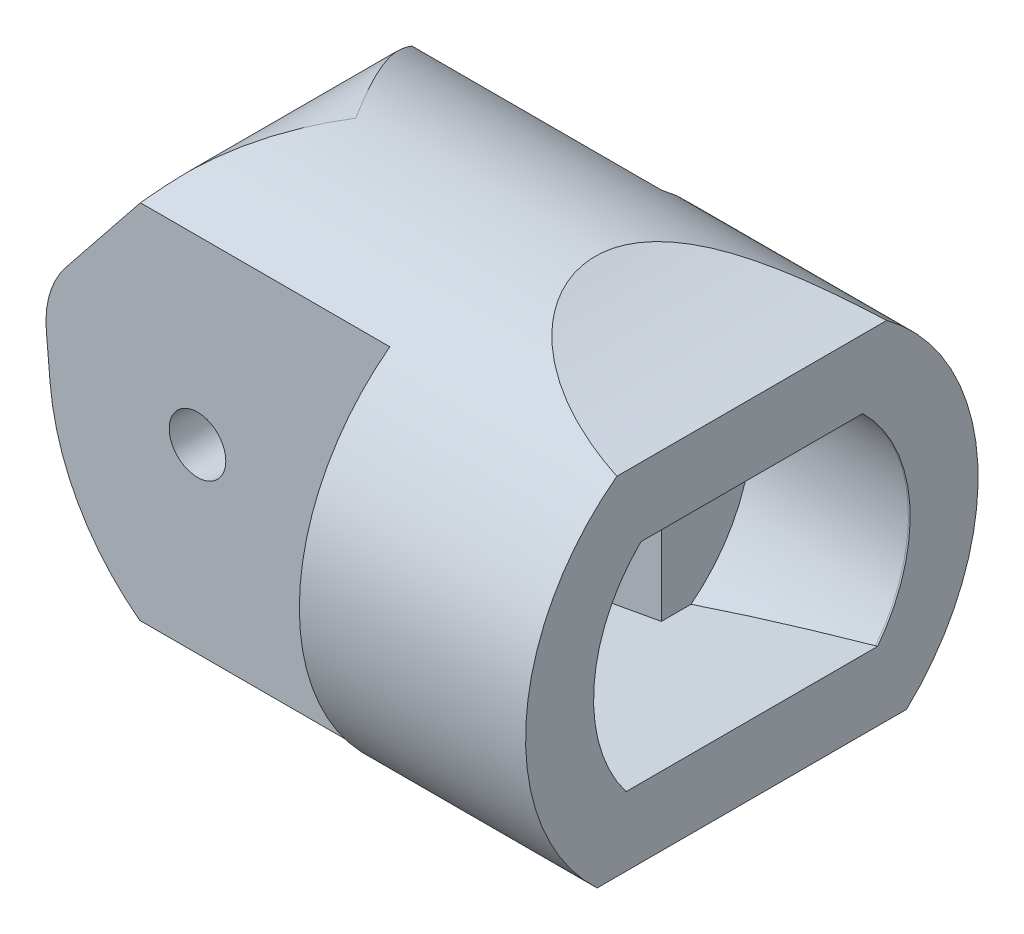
SolidWorks part; units mm, degrees
ref_plane "Plan de face" through (0, 0, 0) normal (0, 0, 1) x (1, 0, 0)
ref_plane "Plan de dessus" through (0, 0, 0) normal (0, 1, 0) x (1, 0, 0)
ref_plane "Plan de droite" through (0, 0, 0) normal (1, 0, 0) x (0, 0, -1)
sketch "Esquisse1" plane through (0, 0, 0) normal (1, 0, 0) x (0, 0, -1)
  circle A0 centre (0, 0) radius 10
  dimension "D1" = 20
extrude "Boss.-Extru.1" add sketch "Esquisse1" against normal blind 26
sketch "Esquisse3" plane through (0, 0, 0) normal (0, 1, 0) x (1, 0, 0)
  line L0 (-26, 0) -> (-26, -6)
  line L2 (0, 0) -> (-26, 0) construction
  line L7 (-26, 10) -> (-26, -10) construction
  line L8 (-26, -10) -> (0, -10) construction
  line L9 (-26, -10) -> (-10, -10)
  line L10 (-26, -10) -> (-26, -6)
  line L11 (-26, 6) -> (-10, 6)
  line L12 (-10, -10) -> (-10, -6)
  line L13 (-10, 10) -> (-10, 6)
  line L14 (-26, -6) -> (-10, -6)
  line L15 (-26, 10) -> (-26, 6)
  line L16 (-26, 10) -> (-10, 10)
  dimension "D4" = 16
  dimension "D5" = 12
extrude "Enlèv. mat.-Extru.1" cut sketch "Esquisse3" against normal through all and the other way through all contours L10 L9 L12 L14 | L15 L11 L13 L16
sketch "Esquisse4" plane through (0, 0, 0) normal (0, 0, 1) x (1, 0, 0)
  line L0 (0, 0) -> (-26, 0) construction
  line L1 (-26, 8) -> (-26, -8) construction
  circle A0 centre (-18.5, 0) radius 1.25
  dimension "D1" = 2.5
  dimension "D2" = 7.5
extrude "Enlèv. mat.-Extru.2" cut sketch "Esquisse4" against normal through all and the other way through all
sketch "Esquisse5" plane through (0, 0, 0) normal (0, 0, 1) x (1, 0, 0)
  line L0 (-25.7147, 6.7385) -> (-25.0489, -0.8716)
  line L1 (-26, -10) -> (0, -10) construction
  line L2 (-15.0869, -10) -> (0, -10)
  line L3 (0, -10) -> (0, 10)
  line L4 (0, 10) -> (-22.7261, 10)
  line L5 (-26, 8) -> (-26, -8) construction
  arc A0 (-15.0869, -10) -> (-25.0489, -0.8716) centre (-15.0869, 0) cw
  arc A1 (-22.7261, 10) -> (-25.7147, 6.7385) centre (-22.7261, 7) ccw
  point P13 (-24.2502, -10)
  point P16 (-26, 10)
  dimension "D2" = 10
  dimension "D3" = 3
  dimension "D1" = 5
extrude "Enlèv. mat.-Extru.3" cut sketch "Esquisse5" against normal through all and the other way through all flip side to cut
sketch "Esquisse6" plane through (0, 0, 0) normal (1, 0, 0) x (0, 0, -1)
  circle A0 centre (0, 0) radius 10
  circle A1 centre (0, 0) radius 10 construction
extrude "Boss.-Extru.2" add sketch "Esquisse6" along normal blind 15 draft 3
sketch "Esquisse7" plane through (0, 0, 0) normal (0, 0, 1) x (1, 0, 0)
  line L0 (0, 10) -> (-17.5013, 10) construction
  line L1 (15, -9.2139) -> (15, 9.2139) construction
  line L2 (15, -4.5865) -> (-14.9606, -10)
  line L3 (-15.0535, -10) -> (0, -10) construction
  line L4 (-14.9606, -10) -> (-14.9606, -14.4411)
  line L5 (-14.9606, -14.4411) -> (23.4972, -14.4411)
  line L6 (23.4972, -14.4411) -> (23.4972, 12.5649)
  line L7 (23.4972, 12.5649) -> (-6.9249, 12.5649)
  line L8 (-6.9249, 12.5649) -> (-6.9249, 10)
  spline S0 degree 3 poles (-6.9249, 10) (-1.613, 7.673) (8.9211, 7.4186) (21.794, 6.6986) (15, -4.5865) knots 0 0 0 0 0.499244 1 1 1 1
extrude "Enlèv. mat.-Extru.4" cut sketch "Esquisse7" against normal through all both and the other way through all
fillet "Congé1" radius 4 2 edges at (15, 1.2954, 9.1224) (15, 1.2954, -9.1224)
sketch "ZONE FSR" plane through (1.2768, -7.0661, 0) normal (0.1778, -0.9841, 0) x (0.9841, 0.1778, 0)
  line L0 (0, 0) -> (19.3909, 0) construction
  circle A0 centre (6.731, 0) radius 7.5 construction
  dimension "D1" = 15
sketch "Esquisse10" plane through (-24.9011, -2.1786, 0) normal (-0.9962, -0.0872, 0) x (0, 0, 1)
  line L1 (-3, 8.9541) -> (3, 8.9541)
  line L2 (-3, 8.9541) -> (-3, -5.0459)
  line L3 (-3, -5.0459) -> (3, -5.0459)
  line L4 (3, 8.9541) -> (3, -5.0459)
  line L5 (-6, 3.2202) -> (-6, 1.312) construction
  line L6 (6, 3.2202) -> (6, 1.312) construction
  point P10 (0, 8.9541)
  dimension "D1" = 3
  dimension "D2" = 3
  dimension "D3" = 14
extrude "Enlèv. mat.-Extru.6" cut sketch "Esquisse10" against normal blind 12
shell "Coque2" thickness 3
sketch "Sketch1" plane through (0, 0, 0) normal (1, 0, 0) x (0, 0, -1)
  line L1 (14.1127, 11.556) -> (-11.984, 11.556)
  line L2 (14.1127, 11.556) -> (14.1127, -10.9495)
  line L3 (14.1127, -10.9495) -> (-11.984, -10.9495)
  line L4 (-11.984, 11.556) -> (-11.984, -10.9495)
extrude "Cut-Extrude1" cut sketch "Sketch1" along normal through all
